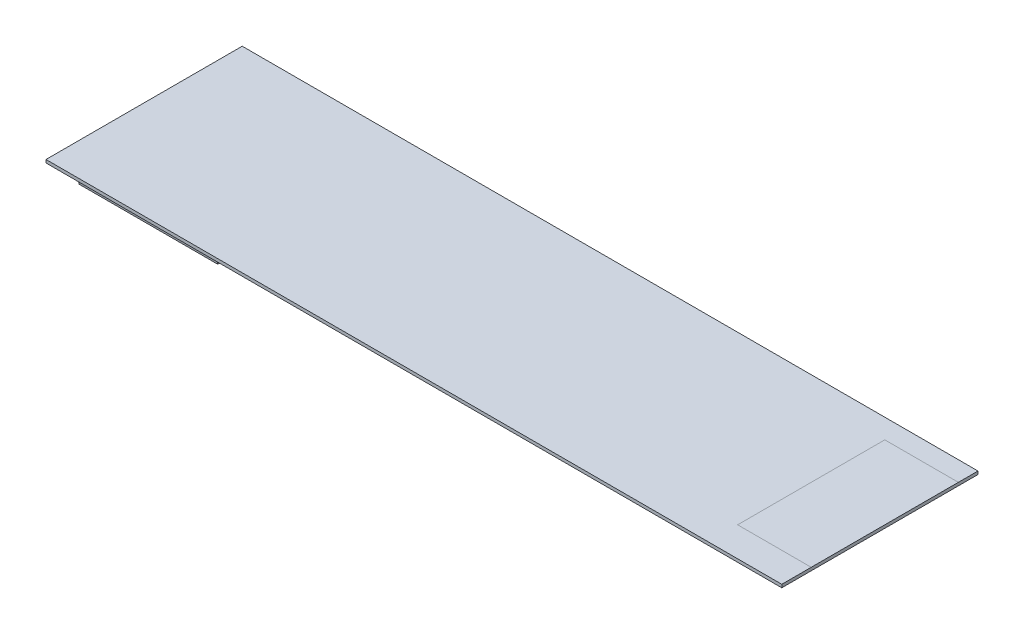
SolidWorks part; units mm, degrees
other "Markup1"
sketch "Sketch2"
ref_plane "Front Plane" through (0, 0, 0) normal (0, 0, 1) x (1, 0, 0)
ref_plane "Top Plane" through (0, 0, 0) normal (0, 1, 0) x (1, 0, 0)
ref_plane "Right Plane" through (0, 0, 0) normal (1, 0, 0) x (0, 0, -1)
sketch "Sketch1" plane through (0, 0, 0) normal (0, 1, 0) x (1, 0, 0)
  line L1 (0, 0) -> (3048, 0)
  line L2 (0, 0) -> (0, 812.8)
  line L3 (0, 812.8) -> (3048, 812.8)
  line L4 (3048, 0) -> (3048, 812.8)
  dimension "D1" = 3048
  dimension "D2" = 812.8
extrude "Boss-Extrude1" add sketch "Sketch1" along normal blind 12.7
sketch "Sketch4" plane through (0, 0, 0) normal (0, -1, 0) x (1, 0, 0)
  line L0 (0, -812.8) -> (0, 0) construction
  line L1 (0, -711.2) -> (609.6, -711.2)
  line L2 (0, -711.2) -> (0, -101.6)
  line L3 (0, -101.6) -> (609.6, -101.6)
  line L4 (609.6, -711.2) -> (609.6, -101.6)
  line L5 (0, -711.2) -> (609.6, -101.6) construction
  line L6 (0, -101.6) -> (609.6, -711.2) construction
  line L9 (0, 0) -> (3048, 0) construction
  point P0 (304.8, -406.4)
  dimension "D1" = 406.4
  dimension "D2" = 609.6
extrude "Boss-Extrude2" add sketch "Sketch4" along normal blind 127 draft 8
sketch "Sketch3" plane through (0, -127, 0) normal (0, -1, 0) x (1, 0, 0)
  line L0 (0, -101.6) -> (0, 0) construction
  line L1 (0, -584.2) -> (508, -584.2)
  line L2 (0, -584.2) -> (0, -177.8)
  line L3 (0, -177.8) -> (508, -177.8)
  line L4 (508, -584.2) -> (508, -177.8)
  line L5 (0, -584.2) -> (508, -177.8) construction
  line L6 (0, -177.8) -> (508, -584.2) construction
  point P0 (254, -381)
  point P7 (0, -50.8)
  dimension "D1" = 508
  dimension "D2" = 508
  dimension "D3" = 177.8
  dimension "D4" = 584.2
extrude "Cut-Extrude1" cut sketch "Sketch3" against normal blind 38.1
sketch "Sketch5" plane through (0, 12.7, 0) normal (0, 1, 0) x (1, 0, 0)
  line L0 (0, 812.8) -> (0, 0) construction
  line L1 (2743.2, 121.92) -> (3048, 121.92)
  line L2 (2743.2, 121.92) -> (2743.2, 731.52)
  line L3 (2743.2, 731.52) -> (3048, 731.52)
  line L4 (3048, 121.92) -> (3048, 731.52)
  line L5 (2743.2, 121.92) -> (3048, 731.52) construction
  line L6 (2743.2, 731.52) -> (3048, 121.92) construction
  line L7 (0, 0) -> (3048, 0) construction
  point P0 (2895.6, 426.72)
  dimension "D1" = 2895.6
  dimension "D2" = 304.8
  dimension "D3" = 609.6
  dimension "D4" = 121.92
